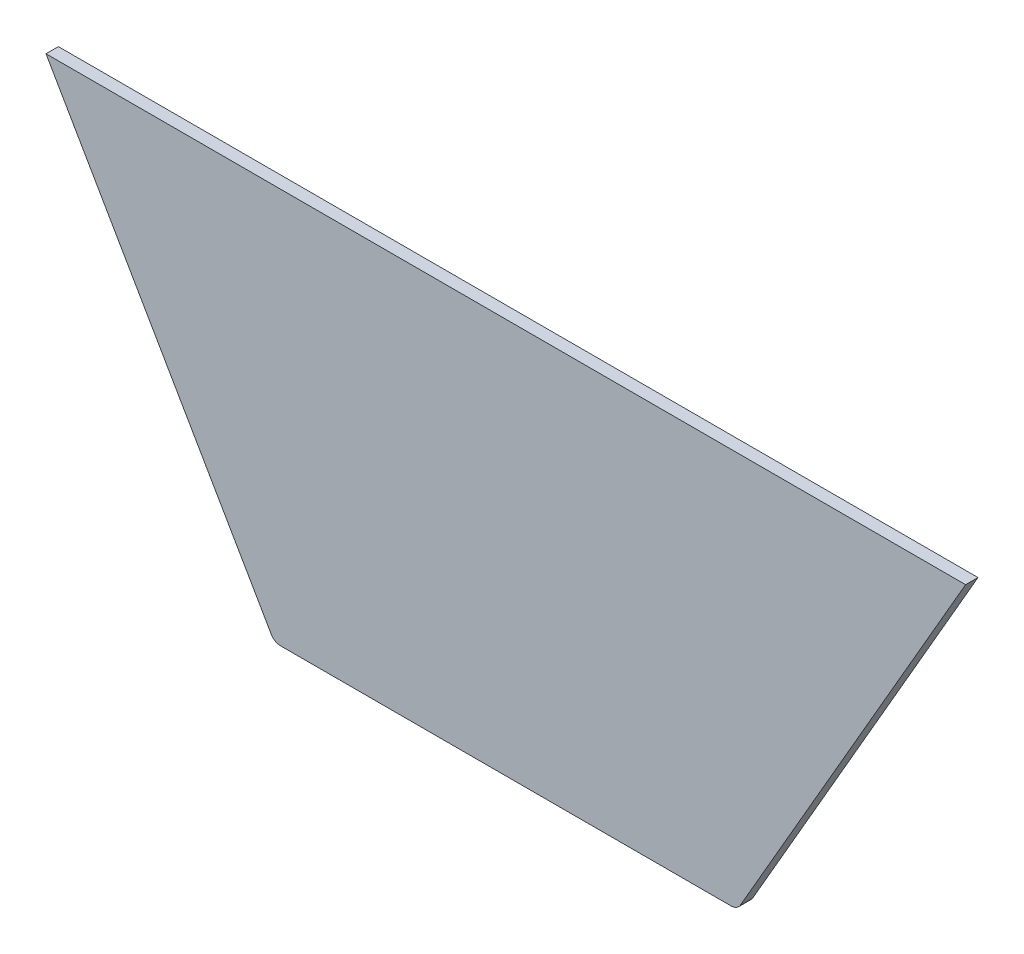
SolidWorks part; units mm, degrees
ref_plane "Front Plane" through (0, 0, 0) normal (0, 0, 1) x (1, 0, 0)
ref_plane "Top Plane" through (0, 0, 0) normal (0, 1, 0) x (1, 0, 0)
ref_plane "Right Plane" through (0, 0, 0) normal (1, 0, 0) x (0, 0, -1)
sketch "Sketch1" plane through (0, 0, 0) normal (0, 0, 1) x (1, 0, 0)
  line L12 (-189.2523, -0.6423) -> (187.997, -0.6423)
  line L18 (-93.0153, -162.8848) -> (91.7599, -162.8848)
  line L19 (95.6094, -160.6623) -> (187.997, -0.6423)
  line L23 (-189.2523, -0.6423) -> (-96.8647, -160.6623)
  arc A18 (-96.8647, -160.6623) -> (-93.0153, -162.8848) centre (-93.0153, -158.4398) ccw
  arc A19 (91.7599, -162.8848) -> (95.6094, -160.6623) centre (91.7599, -158.4398) ccw
extrude "Extrude1" add sketch "Sketch1" along normal blind 5.08
shell "Shell1" thickness 2.54
